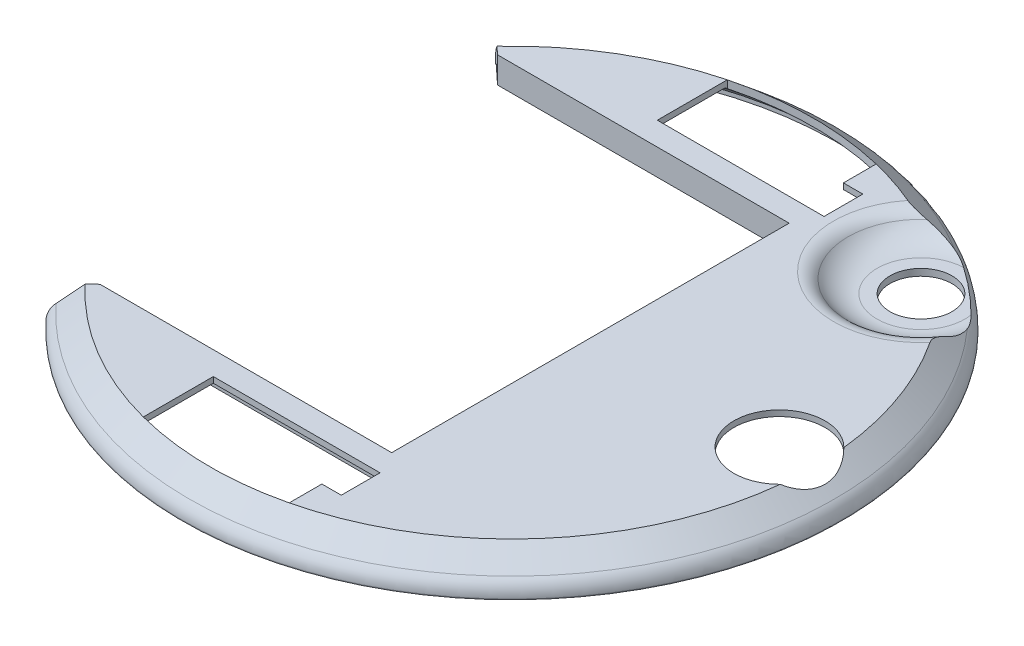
SolidWorks part; units mm, degrees
ref_plane "Plan de face" through (0, 0, 0) normal (0, 0, 1) x (1, 0, 0)
ref_plane "Plan de dessus" through (0, 0, 0) normal (0, 1, 0) x (1, 0, 0)
ref_plane "Plan de droite" through (0, 0, 0) normal (1, 0, 0) x (0, 0, -1)
sketch "Esquisse1" plane through (0, 0, 0) normal (0, 0, 1) x (1, 0, 0)
  line L0 (0, -23.4119) -> (0, 47.3219) construction
  line L1 (-353.1513, 0) -> (56.5372, 0) construction
  line L2 (-170, 0) -> (0, 0)
  line L3 (-170, 0) -> (-170, 0.3369)
  line L4 (-166.4279, 7.9974) -> (-155.699, 17)
  line L5 (-155.699, 17) -> (0, 17)
  line L6 (0, 17) -> (0, 0)
  arc A0 (-166.4279, 7.9974) -> (-170, 0.3369) centre (-160, 0.3369) ccw
  point P16 (-170, 5)
  dimension "D8" = 10
  dimension "D1" = 170
  dimension "D2" = 50
  dimension "D3" = 5
  dimension "D7" = 17
revolve "Révolution1" add sketch "Esquisse1" angle 360 about L0
sketch "Esquisse3" plane through (0, 17, 0) normal (0, 1, 0) x (-1, 0, 0)
  circle A0 centre (-96, -115) radius 16
  dimension "D3" = 32
  dimension "D1" = 115
  dimension "D2" = 96
extrude "Enlèv. mat.-Extru.2" cut sketch "Esquisse3" against normal through all
sketch "Esquisse4" plane through (0, 17, 0) normal (0, 1, 0) x (-1, 0, 0)
  line L0 (0, -235.7333) -> (0, 235.7333) construction
  line L1 (-209.2428, 0) -> (232.6379, 0) construction
  line L2 (-40.5, 102.5) -> (-40.5, -102.5)
  line L3 (-40.5, -102.5) -> (109.9178, -102.5)
  line L4 (0, 0) -> (160.9236, -150.0637) construction
  line L5 (109.9178, -102.5) -> (125.7928, -117.3037)
  line L6 (0, 0) -> (160.9236, 150.0637) construction
  line L7 (109.9178, 102.5) -> (125.7928, 117.3037)
  line L8 (-40.5, 102.5) -> (109.9178, 102.5)
  arc A0 (125.7928, -117.3037) -> (125.7928, 117.3037) centre (0, 0) ccw
  point P17 (-40.5, 0)
  dimension "D4" = 43
  dimension "D2" = 172
  dimension "D1" = 205
  dimension "D3" = 40.5
extrude "Enlèv. mat.-Extru.4" cut sketch "Esquisse4" against normal through all
ref_plane "Plan1" through (0, 7, 0) normal (0, -1, 0) x (1, 0, 0)
sketch "Esquisse5" plane through (0, 7, 0) normal (0, -1, 0) x (1, 0, 0)
  circle A0 centre (96, -115) radius 40
  dimension "D1" = 80
extrude "Enlèv. mat.-Extru.5" cut sketch "Esquisse5" against normal through all
fillet "Congé1" radius 20 1 edges at (70.3664, 7, -84.293)
fillet "Congé2" radius 10 1 edges at (70.3664, 17, -84.293)
sketch "Esquisse6" plane through (0, 0, 0) normal (0, 0, 1) x (1, 0, 0)
  line L0 (0, 45.9991) -> (0, -54.9509) construction
  line L2 (0, 3.5) -> (-168, 3.5)
  line L3 (0, 3.5) -> (0, 0)
  line L4 (0, 0) -> (-168, 0)
  line L5 (-168, 3.5) -> (-168, 0)
  line L6 (-124.3301, 0) -> (170, 0) construction
  dimension "D1" = 3.5
  dimension "D2" = 168
shell "Coque6" thickness 3
revolve "Enlèvement de matière-Révolution2" cut sketch "Esquisse6" angle 360 about L0
sketch "Esquisse7" plane through (0, 17, 0) normal (0, 1, 0) x (-1, 0, 0)
  line L0 (-3.5, 114.5) -> (-3.5, 185.0704) construction
  line L1 (-46.5, 114.5) -> (39.5, 114.5)
  line L2 (-46.5, 114.5) -> (-46.5, 134.5)
  line L3 (-46.5, 134.5) -> (-36.5, 134.5)
  line L4 (39.5, 114.5) -> (39.5, 150.6052)
  line L6 (109.9178, 102.5) -> (-40.5, 102.5) construction
  line L7 (-36.5, 134.5) -> (-36.5, 151.3602)
  line L8 (-3.5, -114.5) -> (-3.5, -185.0704) construction
  line L9 (-36.5, -134.5) -> (-36.5, -151.3602)
  line L10 (39.5, -114.5) -> (39.5, -150.6052)
  line L11 (0, 0) -> (81.2303, 0) construction
  line L12 (-46.5, -134.5) -> (-36.5, -134.5)
  line L13 (-46.5, -114.5) -> (-46.5, -134.5)
  line L14 (-46.5, -114.5) -> (39.5, -114.5)
  line L20 (-40.5, 102.5) -> (-40.5, -102.5) construction
  arc A0 (113.871, 106.1864) -> (-130.0847, -85.5577) centre (0, 0) ccw construction
  arc A1 (39.5, 150.6052) -> (-36.5, 151.3602) centre (0, 0) ccw
  arc A2 (39.5, -150.6052) -> (-36.5, -151.3602) centre (0, 0) cw
  dimension "D1" = 86
  dimension "D2" = 6
  dimension "D3" = 20
  dimension "D4" = 12
  dimension "D5" = 10
extrude "Enlèv. mat.-Extru.6" cut sketch "Esquisse7" against normal through all
sketch "Esquisse8" plane through (0, 17, 0) normal (0, 1, 0) x (-1, 0, 0)
  line L0 (0, 0) -> (-141.5997, 0) construction
  circle A0 centre (-138, 0) radius 23.5
  dimension "D1" = 47
  dimension "D2" = 138
extrude "Enlèv. mat.-Extru.7" cut sketch "Esquisse8" against normal through all
